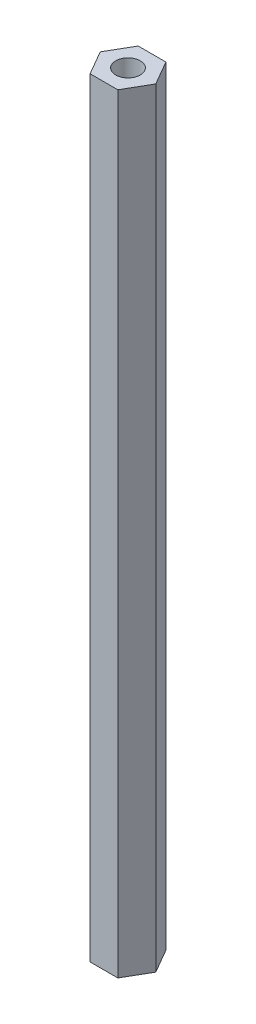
SolidWorks part; units mm, degrees
ref_plane "Front Plane" through (0, 0, 0) normal (0, 0, 1) x (1, 0, 0)
ref_plane "Top Plane" through (0, 0, 0) normal (0, 1, 0) x (1, 0, 0)
ref_plane "Right Plane" through (0, 0, 0) normal (1, 0, 0) x (0, 0, -1)
sketch "Sketch1" plane through (0, 0, 0) normal (0, 1, 0) x (1, 0, 0)
  line L1 (1.8331, 3.175) -> (-1.8331, 3.175)
  line L2 (-1.8331, 3.175) -> (-3.6662, 0)
  line L3 (-3.6662, 0) -> (-1.8331, -3.175)
  line L4 (-1.8331, -3.175) -> (1.8331, -3.175)
  line L5 (1.8331, -3.175) -> (3.6662, 0)
  line L6 (3.6662, 0) -> (1.8331, 3.175)
  circle A0 centre (0, 0) radius 3.175 construction
  circle A1 centre (0, 0) radius 1.6256
  dimension "D2" = 3.2512
  dimension "D1" = 6.35
extrude "Boss-Extrude1" add sketch "Sketch1" along normal blind 101.6
